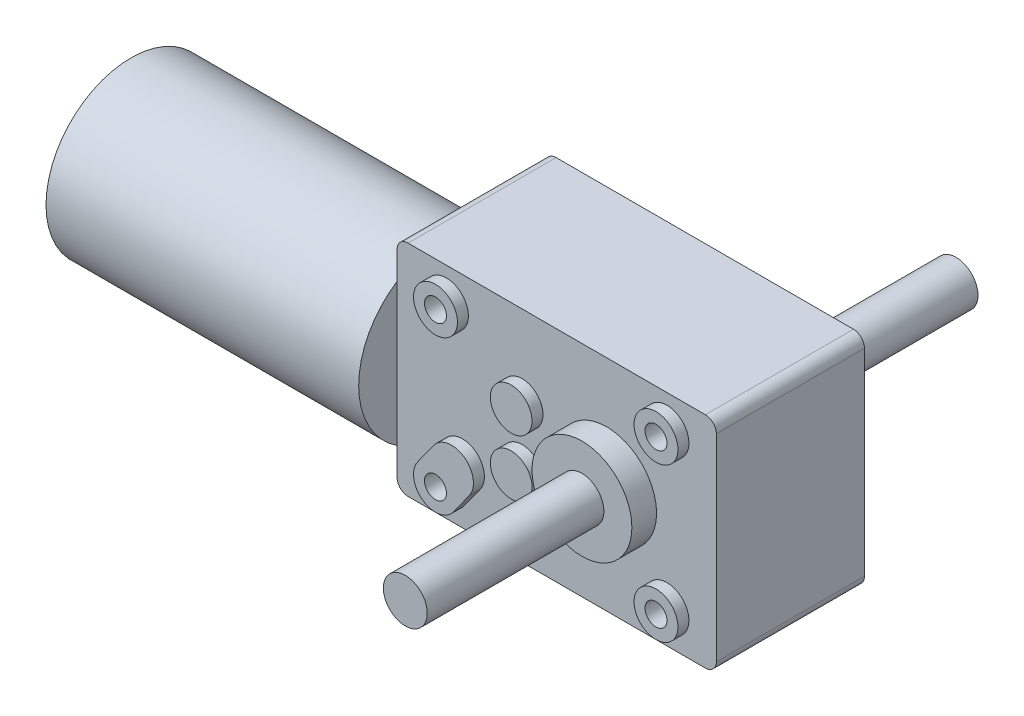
SolidWorks part; units mm, degrees
ref_plane "Plan de face" through (0, 0, 0) normal (0, 0, 1) x (1, 0, 0)
ref_plane "Plan de dessus" through (0, 0, 0) normal (0, 1, 0) x (1, 0, 0)
ref_plane "Plan de droite" through (0, 0, 0) normal (1, 0, 0) x (0, 0, -1)
sketch "Esquisse1" plane through (0, 0, 0) normal (0, 0, 1) x (1, 0, 0)
  line L1 (2, 0) -> (56.2, 0)
  line L2 (0, 2) -> (0, 38)
  line L3 (2, 40) -> (56.2, 40)
  line L4 (58.2, 2) -> (58.2, 38)
  arc A0 (2, 0) -> (0, 2) centre (2, 2) cw
  arc A1 (56.2, 0) -> (58.2, 2) centre (56.2, 2) ccw
  arc A2 (56.2, 40) -> (58.2, 38) centre (56.2, 38) cw
  arc A3 (0, 38) -> (2, 40) centre (2, 38) cw
  point P7 (0, 0)
  point P10 (58.2, 0)
  point P13 (58.2, 40)
  point P16 (0, 40)
  dimension "D3" = 2
  dimension "D1" = 58.2
  dimension "D2" = 40
extrude "Boss.-Extru.1" add sketch "Esquisse1" along normal blind 13.5
sketch "Esquisse2" plane through (0, 0, 13.5) normal (0, 0, 1) x (1, 0, 0)
  line L0 (9, 6) -> (11.9182, 10.0601) construction
  line L1 (5.7519, 8.3345) -> (8.6701, 12.3946)
  line L2 (12.2481, 3.6655) -> (15.1662, 7.7255)
  line L3 (58.2, 2) -> (58.2, 38) construction
  line L4 (0, 38) -> (0, 2) construction
  line L5 (56.2, 40) -> (2, 40) construction
  line L6 (2, 0) -> (56.2, 0) construction
  circle A0 centre (9, 34) radius 4
  circle A1 centre (49.2, 34) radius 4
  circle A2 centre (49.2, 6) radius 4
  circle A4 centre (22.8, 25.2) radius 3.8
  circle A5 centre (22.8, 14.8) radius 3.8
  arc A6 (5.7519, 8.3345) -> (12.2481, 3.6655) centre (9, 6) ccw
  arc A7 (15.1662, 7.7255) -> (8.6701, 12.3946) centre (11.9182, 10.0601) ccw
  point P14 (10.4591, 8.03)
  dimension "D1" = 8
  dimension "D2" = 4
  dimension "D3" = 5
  dimension "D4" = 7.6
  dimension "D7" = 22.8
  dimension "D8" = 14.8
  dimension "D9" = 14.8
  dimension "D10" = 9
  dimension "D11" = 9
  dimension "D12" = 6
  dimension "D13" = 6
extrude "Boss.-Extru.2" add sketch "Esquisse2" along normal blind 2
sketch "Esquisse4" plane through (0, 0, 13.5) normal (0, 0, 1) x (1, 0, 0)
  line L0 (58.2, 2) -> (58.2, 38) construction
  circle A0 centre (38.2, 20) radius 9.1
  point P5 (58.2, 20)
  dimension "D1" = 18.2
  dimension "D2" = 20
extrude "Boss.-Extru.3" add sketch "Esquisse4" along normal blind 4.5
sketch "Esquisse5" plane through (0, 0, 18) normal (0, 0, 1) x (1, 0, 0)
  circle A0 centre (38.2, 20) radius 4
  circle A1 centre (38.2, 20) radius 9.1 construction
  dimension "D1" = 8
extrude "Boss.-Extru.4" add sketch "Esquisse5" along normal blind 32.2
sketch "Esquisse6" plane through (0, 0, 15.5) normal (0, 0, 1) x (1, 0, 0)
  circle A0 centre (9, 34) radius 2
  circle A1 centre (49.2, 34) radius 2
  circle A2 centre (49.2, 6) radius 2
  circle A3 centre (9, 6) radius 2
  circle A4 centre (9, 34) radius 4 construction
  circle A5 centre (49.2, 34) radius 4 construction
  circle A6 centre (49.2, 6) radius 4 construction
  dimension "D1" = 4
extrude "Enlèv. mat.-Extru.1" cut sketch "Esquisse6" against normal blind 5
mirror "Symétrie1" about plane through (2, 2, 0) normal (0, 0, -1) of "Enlèv. mat.-Extru.1", "Boss.-Extru.4", "Boss.-Extru.2", "Boss.-Extru.3", "Boss.-Extru.1"
sketch "Esquisse7" plane through (0, 0, 0) normal (-1, 0, 0) x (0, 0, 1)
  line L0 (-13.5, 29.1) -> (-13.5, 10.9) construction
  line L1 (13.5, 10.9) -> (13.5, 29.1) construction
  circle A0 centre (5, 20) radius 15.5
  point P5 (-13.5, 20)
  dimension "D1" = 31
  dimension "D2" = 8.5
extrude "Boss.-Extru.5" add sketch "Esquisse7" along normal blind 57
sketch "Esquisse8" plane through (-57, 0, 0) normal (-1, 0, 0) x (0, 0, 1)
  circle A0 centre (5, 20) radius 6
  arc A1 (13.5, 32.9615) -> (13.5, 7.0385) centre (5, 20) ccw construction
  dimension "D1" = 12
extrude "Boss.-Extru.6" add sketch "Esquisse8" along normal blind 2
sketch "Esquisse9" plane through (-59, 0, 0) normal (-1, 0, 0) x (0, 0, 1)
  circle A0 centre (5, 20) radius 1.5
  circle A1 centre (5, 20) radius 6 construction
  dimension "D1" = 3
extrude "Boss.-Extru.7" add sketch "Esquisse9" along normal blind 2
